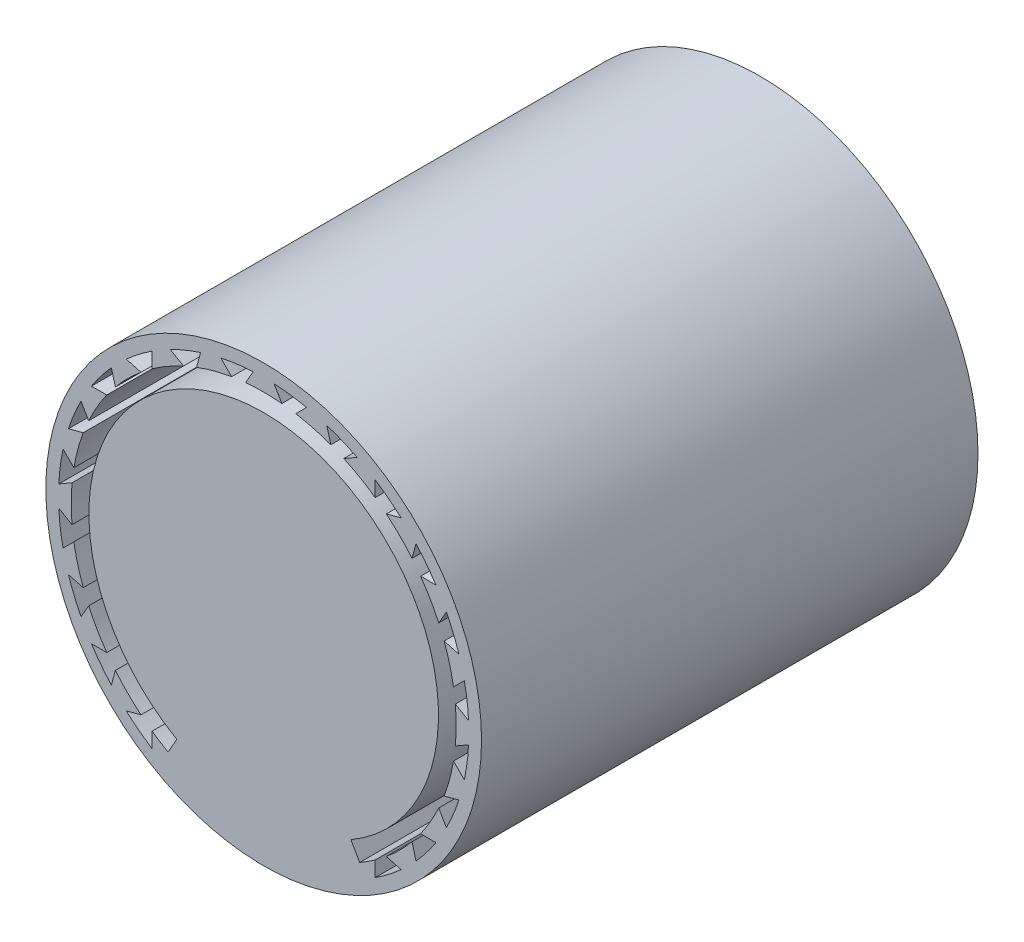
SolidWorks part; units mm, degrees
ref_plane "Plan1" through (0, 0, 0) normal (0, 0, 1) x (1, 0, 0)
ref_plane "Plan2" through (0, 0, 0) normal (0, 1, 0) x (1, 0, 0)
ref_plane "Plan3" through (0, 0, 0) normal (1, 0, 0) x (0, 0, -1)
sketch "Esquisse1" plane through (0, 0, 0) normal (0, 0, 1) x (1, 0, 0)
  line L48 (35.6155, 13.249) -> (38.5334, 12.4672)
  line L49 (36.0628, 18.4316) -> (34.5524, 15.8155)
  line L50 (30.9728, 22.0155) -> (33.9936, 22.0155)
  line L51 (30.0636, 27.1373) -> (29.2817, 24.2194)
  line L52 (24.2194, 29.2817) -> (27.1373, 30.0636)
  line L53 (22.0155, 33.9936) -> (22.0155, 30.9728)
  line L54 (15.8155, 34.5524) -> (18.4316, 36.0628)
  line L55 (12.4672, 38.5334) -> (13.249, 35.6155)
  line L56 (6.3338, 37.4684) -> (8.4698, 39.6045)
  line L57 (2.0692, 40.4471) -> (3.5796, 37.831)
  line L58 (-3.5796, 37.831) -> (-2.0692, 40.4471)
  line L59 (-8.4698, 39.6045) -> (-6.3338, 37.4684)
  line L60 (-13.249, 35.6155) -> (-12.4672, 38.5334)
  line L61 (-18.4316, 36.0628) -> (-15.8155, 34.5524)
  line L62 (-22.0155, 30.9728) -> (-22.0155, 33.9936)
  line L63 (-27.1373, 30.0636) -> (-24.2194, 29.2817)
  line L64 (-29.2817, 24.2194) -> (-30.0636, 27.1373)
  line L65 (-33.9936, 22.0155) -> (-30.9728, 22.0155)
  line L66 (-34.5524, 15.8155) -> (-36.0628, 18.4316)
  line L67 (-38.5334, 12.4672) -> (-35.6155, 13.249)
  line L68 (-37.4684, 6.3338) -> (-39.6045, 8.4698)
  line L69 (-40.4471, 2.0692) -> (-37.831, 3.5796)
  line L70 (-37.831, -3.5796) -> (-40.4471, -2.0692)
  line L71 (-39.6045, -8.4698) -> (-37.4684, -6.3338)
  line L72 (-35.6155, -13.249) -> (-38.5334, -12.4672)
  line L73 (-36.0628, -18.4316) -> (-34.5524, -15.8155)
  line L74 (-30.9728, -22.0155) -> (-33.9936, -22.0155)
  line L75 (-30.0636, -27.1373) -> (-29.2817, -24.2194)
  line L76 (-24.2194, -29.2817) -> (-27.1373, -30.0636)
  line L77 (-22.0155, -33.9936) -> (-22.0155, -30.9728)
  line L78 (-18.885, -32.9751) -> (-17.1455, -29.9379)
  line L79 (-18.885, -32.9751) -> (-17.1455, -29.9379)
  line L80 (17.2079, -29.9021) -> (18.9536, -32.9357)
  line L81 (17.2079, -29.9021) -> (18.9536, -32.9357)
  line L86 (22.0155, -30.9728) -> (22.0155, -33.9936)
  line L87 (27.1373, -30.0636) -> (24.2194, -29.2817)
  line L88 (29.2817, -24.2194) -> (30.0636, -27.1373)
  line L89 (33.9936, -22.0155) -> (30.9728, -22.0155)
  line L90 (34.5524, -15.8155) -> (36.0628, -18.4316)
  line L91 (38.5334, -12.4672) -> (35.6155, -13.249)
  line L92 (37.4684, -6.3338) -> (39.6045, -8.4698)
  line L93 (40.4471, -2.0692) -> (37.831, -3.5796)
  line L94 (37.831, 3.5796) -> (40.4471, 2.0692)
  line L95 (39.6045, 8.4698) -> (37.4684, 6.3338)
  line L96 (35.6155, 13.249) -> (38.5334, 12.4672)
  line L97 (36.0628, 18.4316) -> (34.5524, 15.8155)
  line L98 (30.9728, 22.0155) -> (33.9936, 22.0155)
  line L99 (30.0636, 27.1373) -> (29.2817, 24.2194)
  line L100 (24.2194, 29.2817) -> (27.1373, 30.0636)
  line L101 (22.0155, 33.9936) -> (22.0155, 30.9728)
  line L102 (15.8155, 34.5524) -> (18.4316, 36.0628)
  line L103 (12.4672, 38.5334) -> (13.249, 35.6155)
  line L104 (6.3338, 37.4684) -> (8.4698, 39.6045)
  line L105 (2.0692, 40.4471) -> (3.5796, 37.831)
  line L106 (-3.5796, 37.831) -> (-2.0692, 40.4471)
  line L107 (-8.4698, 39.6045) -> (-6.3338, 37.4684)
  line L108 (-13.249, 35.6155) -> (-12.4672, 38.5334)
  line L109 (-18.4316, 36.0628) -> (-15.8155, 34.5524)
  line L110 (-22.0155, 30.9728) -> (-22.0155, 33.9936)
  line L111 (-27.1373, 30.0636) -> (-24.2194, 29.2817)
  line L112 (-29.2817, 24.2194) -> (-30.0636, 27.1373)
  line L113 (-33.9936, 22.0155) -> (-30.9728, 22.0155)
  line L114 (-34.5524, 15.8155) -> (-36.0628, 18.4316)
  line L115 (-38.5334, 12.4672) -> (-35.6155, 13.249)
  line L116 (-37.4684, 6.3338) -> (-39.6045, 8.4698)
  line L117 (-40.4471, 2.0692) -> (-37.831, 3.5796)
  line L118 (-37.831, -3.5796) -> (-40.4471, -2.0692)
  line L119 (-39.6045, -8.4698) -> (-37.4684, -6.3338)
  line L120 (-35.6155, -13.249) -> (-38.5334, -12.4672)
  line L121 (-36.0628, -18.4316) -> (-34.5524, -15.8155)
  line L122 (-30.9728, -22.0155) -> (-33.9936, -22.0155)
  line L123 (-30.0636, -27.1373) -> (-29.2817, -24.2194)
  line L124 (-24.2194, -29.2817) -> (-27.1373, -30.0636)
  line L125 (-22.0155, -33.9936) -> (-22.0155, -30.9728)
  line L134 (22.0155, -30.9728) -> (22.0155, -33.9936)
  line L135 (27.1373, -30.0636) -> (24.2194, -29.2817)
  line L136 (29.2817, -24.2194) -> (30.0636, -27.1373)
  line L137 (33.9936, -22.0155) -> (30.9728, -22.0155)
  line L138 (34.5524, -15.8155) -> (36.0628, -18.4316)
  line L139 (38.5334, -12.4672) -> (35.6155, -13.249)
  line L140 (37.4684, -6.3338) -> (39.6045, -8.4698)
  line L141 (40.4471, -2.0692) -> (37.831, -3.5796)
  line L142 (37.831, 3.5796) -> (40.4471, 2.0692)
  line L143 (39.6045, 8.4698) -> (37.4684, 6.3338)
  circle A0 centre (0, 0) radius 43
  arc A48 (37.4684, 6.3338) -> (35.6155, 13.249) centre (0, 0) ccw
  arc A49 (38.5334, 12.4672) -> (36.0628, 18.4316) centre (0, 0) ccw
  arc A50 (34.5524, 15.8155) -> (30.9728, 22.0155) centre (0, 0) ccw
  arc A51 (33.9936, 22.0155) -> (30.0636, 27.1373) centre (0, 0) ccw
  arc A52 (29.2817, 24.2194) -> (24.2194, 29.2817) centre (0, 0) ccw
  arc A53 (27.1373, 30.0636) -> (22.0155, 33.9936) centre (0, 0) ccw
  arc A54 (22.0155, 30.9728) -> (15.8155, 34.5524) centre (0, 0) ccw
  arc A55 (18.4316, 36.0628) -> (12.4672, 38.5334) centre (0, 0) ccw
  arc A56 (13.249, 35.6155) -> (6.3338, 37.4684) centre (0, 0) ccw
  arc A57 (8.4698, 39.6045) -> (2.0692, 40.4471) centre (0, 0) ccw
  arc A58 (3.5796, 37.831) -> (-3.5796, 37.831) centre (0, 0) ccw
  arc A59 (-2.0692, 40.4471) -> (-8.4698, 39.6045) centre (0, 0) ccw
  arc A60 (-6.3338, 37.4684) -> (-13.249, 35.6155) centre (0, 0) ccw
  arc A61 (-12.4672, 38.5334) -> (-18.4316, 36.0628) centre (0, 0) ccw
  arc A62 (-15.8155, 34.5524) -> (-22.0155, 30.9728) centre (0, 0) ccw
  arc A63 (-22.0155, 33.9936) -> (-27.1373, 30.0636) centre (0, 0) ccw
  arc A64 (-24.2194, 29.2817) -> (-29.2817, 24.2194) centre (0, 0) ccw
  arc A65 (-30.0636, 27.1373) -> (-33.9936, 22.0155) centre (0, 0) ccw
  arc A66 (-30.9728, 22.0155) -> (-34.5524, 15.8155) centre (0, 0) ccw
  arc A67 (-36.0628, 18.4316) -> (-38.5334, 12.4672) centre (0, 0) ccw
  arc A68 (-35.6155, 13.249) -> (-37.4684, 6.3338) centre (0, 0) ccw
  arc A69 (-39.6045, 8.4698) -> (-40.4471, 2.0692) centre (0, 0) ccw
  arc A70 (-37.831, 3.5796) -> (-37.831, -3.5796) centre (0, 0) ccw
  arc A71 (-40.4471, -2.0692) -> (-39.6045, -8.4698) centre (0, 0) ccw
  arc A72 (-37.4684, -6.3338) -> (-35.6155, -13.249) centre (0, 0) ccw
  arc A73 (-38.5334, -12.4672) -> (-36.0628, -18.4316) centre (0, 0) ccw
  arc A74 (-34.5524, -15.8155) -> (-30.9728, -22.0155) centre (0, 0) ccw
  arc A75 (-33.9936, -22.0155) -> (-30.0636, -27.1373) centre (0, 0) ccw
  arc A76 (-29.2817, -24.2194) -> (-24.2194, -29.2817) centre (0, 0) ccw
  arc A77 (-27.1373, -30.0636) -> (-22.0155, -33.9936) centre (0, 0) ccw
  arc A78 (-22.0155, -30.9728) -> (-18.885, -32.9751) centre (0, 0) ccw
  arc A79 (17.2079, -29.9021) -> (-17.1455, -29.9379) centre (0, 0) ccw
  arc A80 (17.2079, -29.9021) -> (-17.1455, -29.9379) centre (0, 0) ccw
  arc A86 (18.9536, -32.9357) -> (22.0155, -30.9728) centre (0, 0) ccw
  arc A87 (22.0155, -33.9936) -> (27.1373, -30.0636) centre (0, 0) ccw
  arc A88 (24.2194, -29.2817) -> (29.2817, -24.2194) centre (0, 0) ccw
  arc A89 (30.0636, -27.1373) -> (33.9936, -22.0155) centre (0, 0) ccw
  arc A90 (30.9728, -22.0155) -> (34.5524, -15.8155) centre (0, 0) ccw
  arc A91 (36.0628, -18.4316) -> (38.5334, -12.4672) centre (0, 0) ccw
  arc A92 (35.6155, -13.249) -> (37.4684, -6.3338) centre (0, 0) ccw
  arc A93 (39.6045, -8.4698) -> (40.4471, -2.0692) centre (0, 0) ccw
  arc A94 (37.831, -3.5796) -> (37.831, 3.5796) centre (0, 0) ccw
  arc A95 (40.4471, 2.0692) -> (39.6045, 8.4698) centre (0, 0) ccw
  arc A96 (37.4684, 6.3338) -> (35.6155, 13.249) centre (0, 0) ccw
  arc A97 (38.5334, 12.4672) -> (36.0628, 18.4316) centre (0, 0) ccw
  arc A98 (34.5524, 15.8155) -> (30.9728, 22.0155) centre (0, 0) ccw
  arc A99 (33.9936, 22.0155) -> (30.0636, 27.1373) centre (0, 0) ccw
  arc A100 (29.2817, 24.2194) -> (24.2194, 29.2817) centre (0, 0) ccw
  arc A101 (27.1373, 30.0636) -> (22.0155, 33.9936) centre (0, 0) ccw
  arc A102 (22.0155, 30.9728) -> (15.8155, 34.5524) centre (0, 0) ccw
  arc A103 (18.4316, 36.0628) -> (12.4672, 38.5334) centre (0, 0) ccw
  arc A104 (13.249, 35.6155) -> (6.3338, 37.4684) centre (0, 0) ccw
  arc A105 (8.4698, 39.6045) -> (2.0692, 40.4471) centre (0, 0) ccw
  arc A106 (3.5796, 37.831) -> (-3.5796, 37.831) centre (0, 0) ccw
  arc A107 (-2.0692, 40.4471) -> (-8.4698, 39.6045) centre (0, 0) ccw
  arc A108 (-6.3338, 37.4684) -> (-13.249, 35.6155) centre (0, 0) ccw
  arc A109 (-12.4672, 38.5334) -> (-18.4316, 36.0628) centre (0, 0) ccw
  arc A110 (-15.8155, 34.5524) -> (-22.0155, 30.9728) centre (0, 0) ccw
  arc A111 (-22.0155, 33.9936) -> (-27.1373, 30.0636) centre (0, 0) ccw
  arc A112 (-24.2194, 29.2817) -> (-29.2817, 24.2194) centre (0, 0) ccw
  arc A113 (-30.0636, 27.1373) -> (-33.9936, 22.0155) centre (0, 0) ccw
  arc A114 (-30.9728, 22.0155) -> (-34.5524, 15.8155) centre (0, 0) ccw
  arc A115 (-36.0628, 18.4316) -> (-38.5334, 12.4672) centre (0, 0) ccw
  arc A116 (-35.6155, 13.249) -> (-37.4684, 6.3338) centre (0, 0) ccw
  arc A117 (-39.6045, 8.4698) -> (-40.4471, 2.0692) centre (0, 0) ccw
  arc A118 (-37.831, 3.5796) -> (-37.831, -3.5796) centre (0, 0) ccw
  arc A119 (-40.4471, -2.0692) -> (-39.6045, -8.4698) centre (0, 0) ccw
  arc A120 (-37.4684, -6.3338) -> (-35.6155, -13.249) centre (0, 0) ccw
  arc A121 (-38.5334, -12.4672) -> (-36.0628, -18.4316) centre (0, 0) ccw
  arc A122 (-34.5524, -15.8155) -> (-30.9728, -22.0155) centre (0, 0) ccw
  arc A123 (-33.9936, -22.0155) -> (-30.0636, -27.1373) centre (0, 0) ccw
  arc A124 (-29.2817, -24.2194) -> (-24.2194, -29.2817) centre (0, 0) ccw
  arc A125 (-27.1373, -30.0636) -> (-22.0155, -33.9936) centre (0, 0) ccw
  arc A126 (-22.0155, -30.9728) -> (-18.885, -32.9751) centre (0, 0) ccw
  arc A134 (18.9536, -32.9357) -> (22.0155, -30.9728) centre (0, 0) ccw
  arc A135 (22.0155, -33.9936) -> (27.1373, -30.0636) centre (0, 0) ccw
  arc A136 (24.2194, -29.2817) -> (29.2817, -24.2194) centre (0, 0) ccw
  arc A137 (30.0636, -27.1373) -> (33.9936, -22.0155) centre (0, 0) ccw
  arc A138 (30.9728, -22.0155) -> (34.5524, -15.8155) centre (0, 0) ccw
  arc A139 (36.0628, -18.4316) -> (38.5334, -12.4672) centre (0, 0) ccw
  arc A140 (35.6155, -13.249) -> (37.4684, -6.3338) centre (0, 0) ccw
  arc A141 (39.6045, -8.4698) -> (40.4471, -2.0692) centre (0, 0) ccw
  arc A142 (37.831, -3.5796) -> (37.831, 3.5796) centre (0, 0) ccw
  arc A143 (40.4471, 2.0692) -> (39.6045, 8.4698) centre (0, 0) ccw
  dimension "D2" = 86
  dimension "D1" = 0
extrude "Base-Extrusion" add sketch "Esquisse1" against normal blind 98
ref_plane "Plan milieu" through (0, 0, -49) normal (0, 0, 1) x (1, 0, 0)
